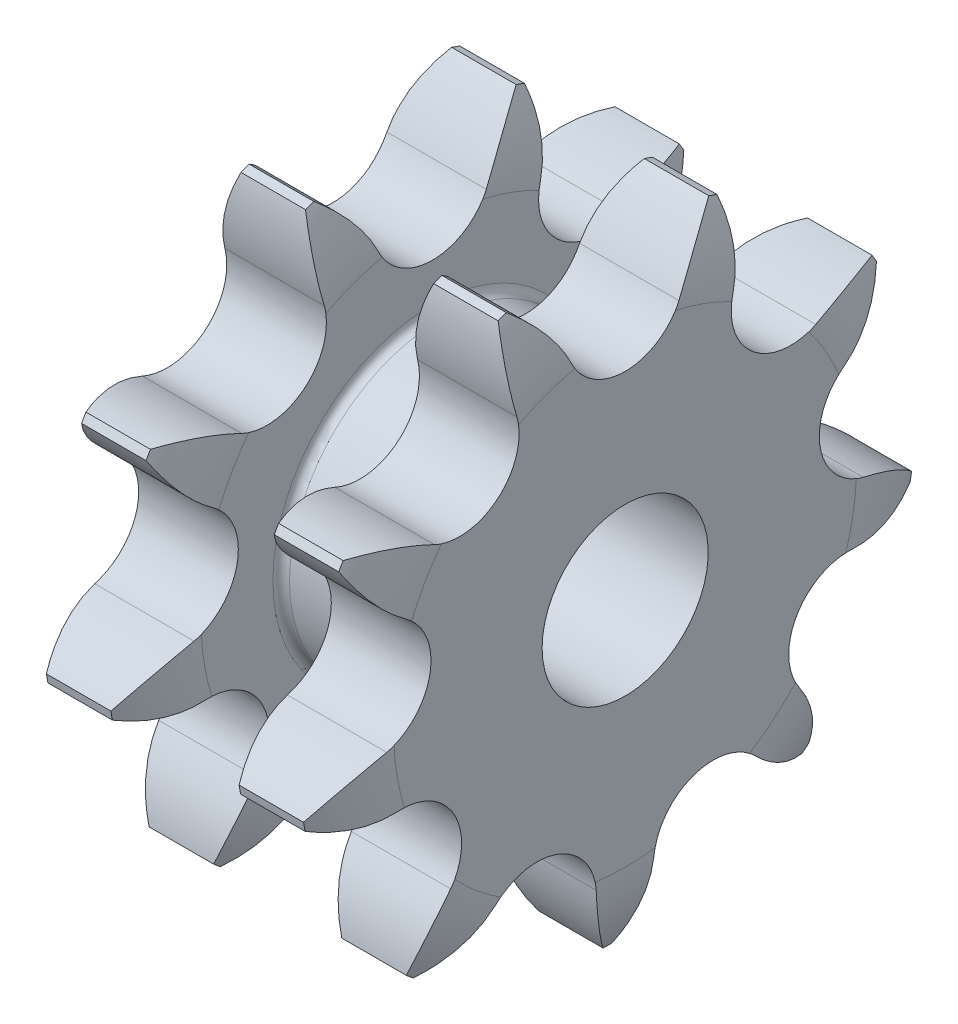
SolidWorks part; units mm, degrees
ref_plane "Plane1" through (0, 0, 0) normal (0, 0, 1) x (1, 0, 0)
ref_plane "Plane2" through (0, 0, 0) normal (0, 1, 0) x (1, 0, 0)
ref_plane "Plane3" through (0, 0, 0) normal (1, 0, 0) x (0, 0, -1)
sketch "Clipboard" plane through (0, 0, 0) normal (0, 1, 0) x (1, 0, 0)
  line L0 (0, 0) -> (12.5436, -1.9867)
  line L1 (-15, 0) -> (100, 0) construction
  line L2 (0, 0) -> (-0.8416, 0.9512)
  line L3 (0, 0) -> (-11.863, 4.5341)
  line L4 (0, 0) -> (3.0618, 0.4849)
  line L5 (0, 0) -> (-2.8109, -1.0484)
  line L6 (0, 0) -> (-17.5077, -11.8125)
  line L7 (-0.8416, 0.9512) -> (22.0505, 5.4009)
  line L8 (-76.2, 38.1) -> (-75.2, 38.1)
  line L9 (-73.4259, 41.6592) -> (-72.8306, 41.7344)
  line L10 (-73.4741, 12.7512) -> (-59.5541, 12.7512)
  circle A0 centre (0, 0) radius 4.255
  circle A1 centre (0, 0) radius 10.9305
  circle A2 centre (0, 0) radius 25
sketch "BasProSke" plane through (0, 0, 0) normal (0, 1, 0) x (1, 0, 0)
  line L0 (-10, 0) -> (60, 0) construction
  line L1 (0, 0) -> (0, 16.7129)
  line L2 (0, 0) -> (21.12, 0)
  line L3 (21.12, 0) -> (21.12, 16.7129)
  line L4 (19.85, 22.2487) -> (1.27, 22.2487)
  arc A0 (0, 16.7129) -> (1.27, 22.2487) centre (12.7, 16.7129) cw
  arc A1 (21.12, 16.7129) -> (19.85, 22.2487) centre (8.42, 16.7129) ccw
revolve "Base-Revolve" add sketch "BasProSke" angle 360 about L0
sketch "GrvSke" plane through (0, 0, 0) normal (0, 1, 0) x (1, 0, 0)
  line L0 (7.2, 16.7129) -> (7.2, 11.5305)
  line L1 (7.8, 10.9305) -> (13.32, 10.9305)
  line L2 (13.92, 11.5305) -> (13.92, 16.7129)
  line L3 (5.93, 22.2487) -> (15.19, 22.2487)
  line L4 (10.56, 0) -> (10.56, 52.07) construction
  line L5 (-10, 0) -> (60, 0) construction
  line L6 (0, 0) -> (35.56, 0) construction
  arc A0 (13.92, 16.7129) -> (15.19, 22.2487) centre (26.62, 16.7129) cw
  arc A1 (7.2, 16.7129) -> (5.93, 22.2487) centre (-5.5, 16.7129) ccw
  arc A2 (7.2, 11.5305) -> (7.8, 10.9305) centre (7.8, 11.5305) ccw
  arc A3 (13.32, 10.9305) -> (13.92, 11.5305) centre (13.32, 11.5305) ccw
revolve "Groove" cut sketch "GrvSke" angle 360 about L6
sketch "TooCutSke" plane through (0, 0, 0) normal (1, 0, 0) x (0, 0, -1)
  line L0 (0, 18.6087) -> (3.8949, 16.7925) construction
  line L1 (0, 0) -> (0, 107) construction
  line L2 (0, 18.6087) -> (-10, 18.6087) construction
  line L3 (0, 18.6087) -> (-3.8949, 16.7925) construction
  arc A0 (3.8949, 16.7925) -> (7.8075, 21.3669) centre (14.0756, 12.0451) cw
  arc A1 (3.8949, 16.7925) -> (-3.8949, 16.7925) centre (0, 18.6087) cw
  arc A2 (-3.8949, 16.7925) -> (-7.8075, 21.3669) centre (-14.0756, 12.0451) ccw
  arc A3 (7.8075, 21.3669) -> (-7.8075, 21.3669) centre (0, 0) ccw
extrude "ToothCut" cut sketch "TooCutSke" along normal through all
pattern_circular "TeethCuts" count 9 every 40 about axis through (-10, 0, 0) along (1, 0, 0) of "ToothCut"
sketch "HubNeaOneSke" plane through (0, 0, 0) normal (-1, 0, 0) x (0, 0, 1)
  circle A0 centre (0, 0) radius 10.9305
extrude "HubNearOne" [suppressed] add sketch "HubNeaOneSke" along normal blind 2.2005
fillet "HubNearOneFillet" [suppressed] radius 0.6
sketch "HubNeaBotSke" plane through (0, 0, 0) normal (-1, 0, 0) x (0, 0, 1)
  circle A0 centre (0, 0) radius 10.9305
extrude "HubNearBoth" [suppressed] add sketch "HubNeaBotSke" along normal blind 1.1003
fillet "HubNearBothFillet" [suppressed] radius 0.6
ref_plane "FarPln" through (21.12, 0, 0) normal (1, 0, 0) x (0, 0, -1)
sketch "HubFarSke" plane through (21.12, 0, 0) normal (1, 0, 0) x (0, 0, -1)
  circle A0 centre (0, 0) radius 10.9305
extrude "HubFar" [suppressed] add sketch "HubFarSke" along normal blind 1.1003
fillet "HubFarFillet" [suppressed] radius 0.6
sketch "BorSke" plane through (0, 0, 0) normal (1, 0, 0) x (0, 0, -1)
  circle A0 centre (0, 0) radius 6
extrude "Bore" cut sketch "BorSke" along normal mid plane 46.641
sketch "KeySke" plane through (0, 0, 0) normal (1, 0, 0) x (0, 0, -1)
  line L0 (-1, 0) -> (-1, 7)
  line L1 (-1, 7) -> (1, 7)
  line L2 (1, 7) -> (1, 0)
  line L3 (0, 0) -> (0, 34) construction
  line L4 (-1, 0) -> (1, 0)
extrude "Keyway" [suppressed] cut sketch "KeySke" along normal mid plane 46.641
pattern_circular "Keyway2" [suppressed] count 2 every 90 about axis through (-10, 0, 0) along (1, 0, 0)
equation "' \"Pitch@Clipboard\" = 12.7"
equation "' \"Num_strands@Clipboard\" = 2"
equation "' \"Num_teeth@Clipboard\" = 9"
equation "' \"Hub_dia@Clipboard\" = 50"
equation "' \"Overall_len@Clipboard\" = 3"
equation "' \"Diameter@BorSke\" = 12"
equation "' \"T_dim@Clipboard\" = 1"
equation "' \"Width@KeySke\" = 2"
equation "' \"Dr@Clipboard\" = 8.51"
equation "' \"Face_width@Clipboard\" = 7.2"
equation "' \"Side_radius@Clipboard\" = 12.7"
equation "' \"Side_relief@Clipboard\" = 1.27"
equation "' \"Transv_pitch@Clipboard\" = 13.92"
equation "' \"Show_teeth@Clipboard\" = 9"
equation "' \"Fillet_rad@Clipboard\" = 0.6"
equation "' \"Plate_wid@Clipboard\" = 11.8"
equation "\"Num_teeth@Clipboard\" = int( \"Num_teeth@Clipboard\" )"
equation "\"Num_teeth@Clipboard\" = ((sgn( \"Num_teeth@Clipboard\" - 5.0)+1)*( \"Num_teeth@Clipboard\" - 5.0))/2 +5.0"
equation "\"Num_teeth@Clipboard\" = ((sgn( \"Num_teeth@Clipboard\" - 200.0)-1)*( \"Num_teeth@Clipboard\" - 200.0))/-2 +200.0"
equation "\"MHD@Clipboard\" = \"Pitch@Clipboard\" * (1.0 / tan(3.14159265 / \"Num_teeth@Clipboard\" )) - 1.04 * \"Plate_wid@Clipboard\" - 0.76"
equation "\"Thickness@Clipboard\"  = \"Face_width@Clipboard\" + (\"Num_strands@Clipboard\" - 1) * \"Transv_pitch@Clipboard\""
equation "\"OAL@Clipboard\" = \"Thickness@Clipboard\" + 2 * \"Fillet_rad@Clipboard\" + 1"
equation "\"MHD@Clipboard\" = ((sgn( \"MHD@Clipboard\" - \"Hub_dia@Clipboard\" )-1)*( \"MHD@Clipboard\" - \"Hub_dia@Clipboard\" ))/-2+ \"Hub_dia@Clipboard\""
equation "\"OAL@Clipboard\" = ((sgn( \"OAL@Clipboard\" - \"Overall_len@Clipboard\" )+1)*( \"OAL@Clipboard\" - \"Overall_len@Clipboard\" ))/2 + \"Overall_len@Clipboard\" + 0.0005"
equation "\"Num_teeth@TeethCuts\" = int( \"Show_teeth@Clipboard\" ) + 1"
equation "\"Num_teeth@TeethCuts\" = ((sgn( \"Num_teeth@TeethCuts\" - \"Num_teeth@Clipboard\" )-1)*( \"Num_teeth@TeethCuts\" - \"Num_teeth@Clipboard\" ))/-2+ \"Num_teeth@Clipboard\""
equation "\"Num_teeth@TeethCuts\" = ((sgn( \"Num_teeth@TeethCuts\" - 2.0)+1)*( \"Num_teeth@TeethCuts\" - 2.0))/2 +2.0"
equation "\"Angle@TeethCuts\" = 360.0 / \"Num_teeth@Clipboard\""
equation "\"Seat_radius@TooCutSke\" = ( \"Pitch@Clipboard\" / 2.0) / sin(3.14159265 / \"Num_teeth@Clipboard\" ) - \"Dr@Clipboard\" / 2.0 + \"Dr@Clipboard\" * 0.505"
equation "\"R1@TooCutSke\"  = \"Dr@Clipboard\" * 0.505"
equation "\"X@TooCutSke\" = 140.0 - (90.0 / \"Num_teeth@Clipboard\")"
equation "\"R2@TooCutSke\" = 0.12 * \"Dr@Clipboard\" * ( \"Num_teeth@Clipboard\" + 2.0)"
equation "\"Overcut@TooCutSke\" = 0.5 + 0.625 * \"Pitch@Clipboard\" - 0.5 * \"Dr@Clipboard\"  +  \"Pitch@Clipboard\" / 2.0 / sin(3.14159265 / \"Num_teeth@Clipboard\" )"
equation "\"Diameter@BasProSke\" = 2.0 * ( 0.625 * \"Pitch@Clipboard\" - 0.5 * \"Dr@Clipboard\"  +  \"Pitch@Clipboard\" / 2.0 / sin(3.14159265 / \"Num_teeth@Clipboard\" ))"
equation "\"Thickness@BasProSke\"  = \"Thickness@Clipboard\""
equation "\"G1@BasProSke\" =  \"Side_relief@Clipboard\""
equation "\"G2@BasProSke\" =  \"Side_relief@Clipboard\""
equation "\"D1@BasProSke\" =  \"Side_radius@Clipboard\""
equation "\"Diameter@GrvSke\" = \"Diameter@BasProSke\""
equation "\"G1@GrvSke\" = \"Side_relief@Clipboard\""
equation "\"D1@GrvSke\" = \"Side_radius@Clipboard\""
equation "\"Grv_diam@GrvSke\" =  \"Pitch@Clipboard\" * (1.0 / tan(3.14159265 / \"Num_teeth@Clipboard\" ))- 1.04 * \"Plate_wid@Clipboard\" - 0.76"
equation "\"Grv_width@GrvSke\" =  \"Transv_pitch@Clipboard\" - \"Face_width@Clipboard\""
equation "\"Offset@GrvSke\" = \"Grv_width@GrvSke\" / 2.0 + \"Face_width@Clipboard\""
equation "\"Fillet_rad@GrvSke\" = \"Fillet_rad@Clipboard\""
equation "\"Diameter@HubNeaOneSke\" = \"MHD@Clipboard\""
equation "\"Length@HubNearOne\" = \"OAL@Clipboard\" - \"Thickness@BasProSke\""
equation "\"Diameter@HubNeaBotSke\" = \"MHD@Clipboard\""
equation "\"Length@HubNearBoth\" = ( \"OAL@Clipboard\" - \"Thickness@BasProSke\" ) / 2.0"
equation "\"D1@HubNearOneFillet\" = \"Fillet_rad@Clipboard\""
equation "\"D1@HubNearBothFillet\" = \"Fillet_rad@Clipboard\""
equation "\"Thickness@FarPln\" = \"Thickness@BasProSke\""
equation "\"Diameter@HubFarSke\" = \"MHD@Clipboard\""
equation "\"Length@HubFar\" = ( \"OAL@Clipboard\" - \"Thickness@BasProSke\" ) / 2.0"
equation "\"D1@HubFarFillet\" = \"Fillet_rad@Clipboard\""
equation "\"D1@Bore\" = \"OAL@Clipboard\" * 2.0"
equation "\"D1@Keyway\" = \"OAL@Clipboard\" * 2.0"
equation "\"Offset@KeySke\" = \"T_dim@Clipboard\" + \"Diameter@BorSke\" / 2.0"
